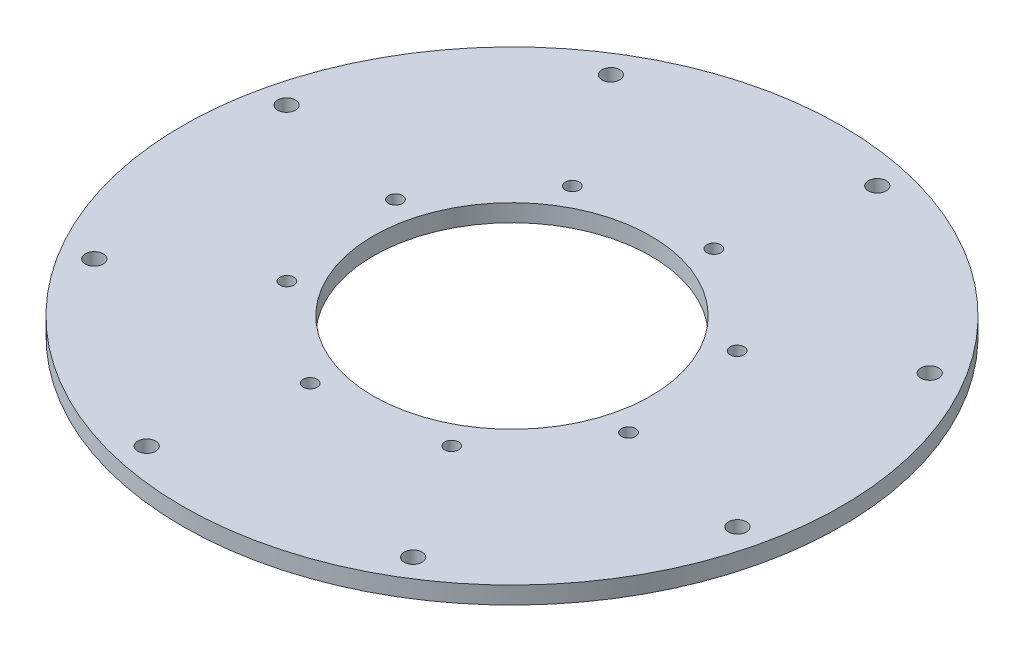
SolidWorks part; units mm, degrees
ref_plane "Front Plane" through (0, 0, 0) normal (0, 0, 1) x (1, 0, 0)
ref_plane "Top Plane" through (0, 0, 0) normal (0, 1, 0) x (1, 0, 0)
ref_plane "Right Plane" through (0, 0, 0) normal (1, 0, 0) x (0, 0, -1)
sketch "Sketch1" plane through (0, 0, 0) normal (0, 1, 0) x (1, 0, 0)
  circle A0 centre (0, 0) radius 120.65
  dimension "D1" = 241.3
extrude "Boss-Extrude1" add sketch "Sketch1" along normal blind 6.35
sketch "Sketch2" plane through (0, 6.35, 0) normal (0, 1, 0) x (1, 0, 0)
  circle A0 centre (0, 0) radius 50.8
  dimension "D1" = 101.6
extrude "Cut-Extrude1" cut sketch "Sketch2" against normal through all
hole_wizard "F (0.257) Diameter Hole1" positions "Sketch3" profile "Sketch4" hole size "F" standard "ANSI Inch"
sketch "Sketch3" plane through (0, 6.35, 0) normal (0, 1, 0) x (1, 0, 0)
  point P0 (25.5902, 108.1384)
  point P3 (94.5604, 58.3703)
  point P6 (-58.3703, 94.5604)
  point P9 (108.1384, -25.5902)
  point P12 (58.3703, -94.5604)
  point P15 (-25.5902, -108.1384)
  point P18 (-94.5604, -58.3703)
  point P21 (-108.1384, 25.5902)
sketch "Sketch4" plane through (25.5902, 6.35, -108.1384) normal (1, 0, 0) x (0, 0, 1)
  line L0 (0, 0) -> (0, 19.2331)
  line L1 (0, 19.2331) -> (3.2639, 17.272)
  line L2 (3.2639, 17.272) -> (3.2639, 0)
  line L5 (3.2639, 0) -> (0, 0)
  line L10 (0, 19.2331) -> (-3.2639, 17.272) construction
  line L11 (0, -6.35) -> (0, 107.95) construction
  dimension "Hole Dia." = 6.5278
  dimension "Hole Depth" = 17.272
  dimension "Drill Angle" = 118
hole_wizard "Tapped Hole for #10-32 Helicoil1" positions "Sketch7" profile "Sketch8" tap size "#10-32" standard "Helicoil® Inch"
sketch "Sketch7" plane through (0, 0, 0) normal (0, -1, 0) x (-1, 0, 0)
  point P0 (52.2448, -30.1593)
  point P3 (58.2685, 15.6168)
  point P6 (30.1593, 52.2448)
  point P9 (-15.6168, 58.2685)
  point P12 (-52.2448, 30.1593)
  point P15 (-58.2685, -15.6168)
  point P18 (-30.1593, -52.2448)
  point P21 (15.6168, -58.2685)
sketch "Sketch8" plane through (-52.2448, 0, 30.1593) normal (1, 0, 0) x (0, 0, -1)
  line L0 (0, 0) -> (0, 13.4718)
  line L1 (0, 13.4718) -> (2.5527, 11.938)
  line L2 (2.5527, 11.938) -> (2.5527, 0)
  line L5 (2.5527, 0) -> (0, 0)
  line L10 (0, 13.4718) -> (-2.5527, 11.938) construction
  line L11 (0, -6.35) -> (0, 107.95) construction
  dimension "Tap Drill Dia." = 5.1054
  dimension "Tap Drill Depth" = 11.938
  dimension "Drill Angle" = 118
